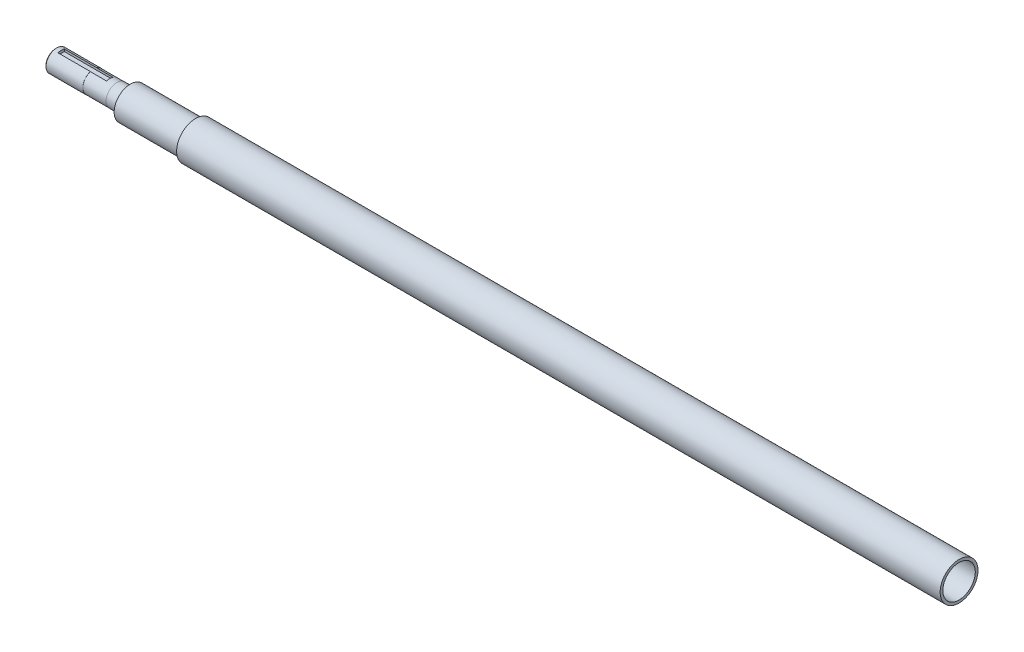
SolidWorks part; units mm, degrees
ref_plane "Front" through (0, 0, 0) normal (0, 0, 1) x (1, 0, 0)
ref_plane "Top" through (0, 0, 0) normal (0, 1, 0) x (1, 0, 0)
ref_plane "Right" through (0, 0, 0) normal (1, 0, 0) x (0, 0, -1)
sketch "Esquisse1" plane through (0, 0, 0) normal (0, 0, 1) x (1, 0, 0)
  line L0 (1035.6434, 0) -> (-993.1535, 0) construction
  line L1 (-371.5, 35) -> (1040.5, 35)
  line L2 (-517, 20) -> (-492, 20)
  line L3 (-630, 0) -> (630, 0)
  line L4 (630, 30) -> (630, 0)
  line L5 (-517, 20) -> (-517, 19.8)
  line L6 (-492, 30) -> (-492, 20)
  line L7 (-371.5, 35) -> (-371.5, 30)
  line L8 (1040.5, 35) -> (1040.5, 30)
  line L9 (-630, 20) -> (-560, 20)
  line L10 (-560, 19.8) -> (-517, 19.8)
  line L11 (-560, 20) -> (-560, 19.8)
  line L12 (-630, 20) -> (-630, 0)
  line L13 (-492, 30) -> (-371.5, 30)
  line L15 (1040.5, 30) -> (630, 30)
  dimension "D2" = 1260
  dimension "D4" = 25
  dimension "D5" = 120.5
  dimension "D6" = 1412
  dimension "D9" = 35
  dimension "D10" = 20
  dimension "D11" = 19.8
revolve "Base-Révolution" add sketch "Esquisse1" angle 360 about L0
ref_plane "Plan1" through (-620, 0, 0) normal (1, 0, 0) x (0, 0, -1)
sketch "Esquisse2" plane through (-620, 0, 0) normal (1, 0, 0) x (0, 0, -1)
  line L1 (-6, 21) -> (6, 21)
  line L2 (-6, 21) -> (-6, 15)
  line L3 (-6, 15) -> (6, 15)
  line L4 (6, 21) -> (6, 15)
  circle A0 centre (0, 0) radius 35 construction
  dimension "D1" = 12
  dimension "D2" = 6
  dimension "D3" = 15
  dimension "D4" = 6
extrude "Enlèv. mat.-Extru.1" cut sketch "Esquisse2" along normal blind 90
hole_wizard "Trou taraudé M16x2.01" positions "Esquisse4" profile "Esquisse3" tap size "M16x2.0" standard "ISO"
sketch "Esquisse4" plane through (-630, 0, 0) normal (-1, 0, 0) x (0, 0, 1)
  point P0 (0, 0)
sketch "Esquisse3" plane through (-630, 0, 0) normal (0, 1, 0) x (0, 0, 1)
  line L0 (0, 0) -> (0, 54.206)
  line L1 (0, 54.206) -> (7, 50)
  line L2 (7, 50) -> (7, 40)
  line L3 (7, 40) -> (8, 40)
  line L4 (8, 40) -> (8, 0)
  line L5 (8, 0) -> (0, 0)
  line L10 (0, 54.206) -> (-7, 50) construction
  line L11 (0, -6.35) -> (0, 107.95) construction
  dimension "Diamètre du trou pour taraudage" = 14
  dimension "Profondeur du trou pour taraudage" = 50
  dimension "Diamètre du filetage" = 16
  dimension "Profondeur du filetage" = 40
  dimension "Angle de pointe" = 118
chamfer "Chanfrein1" distance 2 angle 45 2 edges at (630, 0, -30) (-630, 0, -20)
